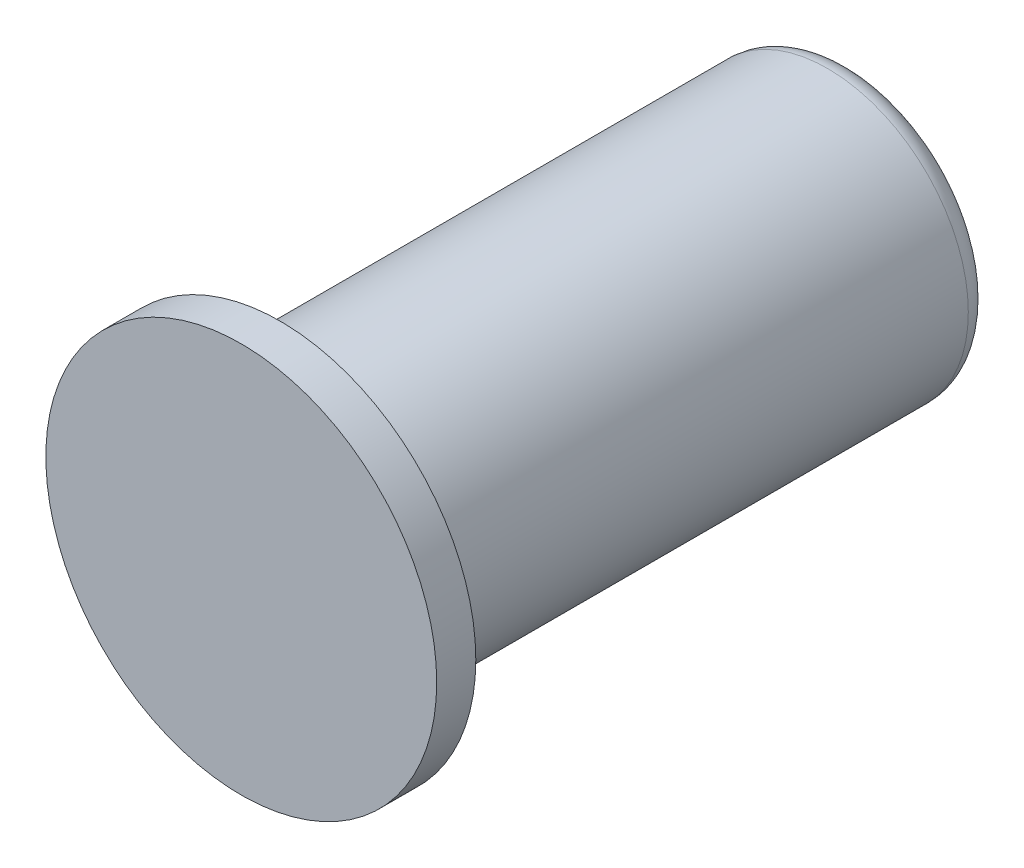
SolidWorks part; units mm, degrees
ref_plane "Front Plane" through (0, 0, 0) normal (0, 0, 1) x (1, 0, 0)
ref_plane "Top Plane" through (0, 0, 0) normal (0, 1, 0) x (1, 0, 0)
ref_plane "Right Plane" through (0, 0, 0) normal (1, 0, 0) x (0, 0, -1)
sketch "Sketch1" plane through (0, 0, 0) normal (1, 0, 0) x (0, 0, -1)
  line L0 (0, 0) -> (78, 0) construction
  line L1 (0, 0) -> (0, 25)
  line L2 (0, 25) -> (5, 25)
  line L3 (5, 25) -> (5, 18)
  line L4 (5, 18) -> (75, 18)
  line L5 (78, 4.5) -> (78, 15)
  line L6 (77.5, 4) -> (69, 4)
  line L7 (69, 4) -> (66.6906, 0)
  line L8 (77.5, 4) -> (78, 4.5)
  line L9 (0, 0) -> (66.6906, 0)
  arc A0 (75, 18) -> (78, 15) centre (75, 15) cw
  point P13 (78, 18)
  dimension "D10" = 3
  dimension "D1" = 18
  dimension "D2" = 25
  dimension "D3" = 45
  dimension "D4" = 0.5
  dimension "D5" = 73
  dimension "D6" = 5
  dimension "D7" = 60
  dimension "D8" = 9
  dimension "D9" = 4
revolve "Revolve1" add sketch "Sketch1" angle 360 about L0
